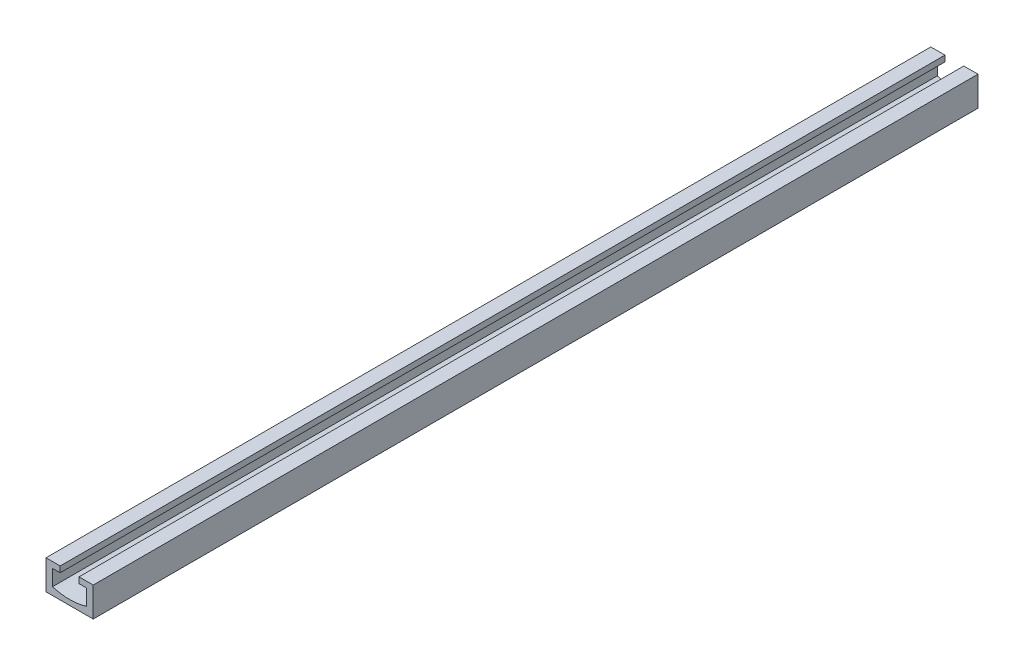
SolidWorks part; units mm, degrees
ref_plane "前视基准面" through (0, 0, 0) normal (0, 0, 1) x (1, 0, 0)
ref_plane "上视基准面" through (0, 0, 0) normal (0, 1, 0) x (1, 0, 0)
ref_plane "右视基准面" through (0, 0, 0) normal (1, 0, 0) x (0, 0, -1)
sketch "草图1" plane through (0, 0, 0) normal (0, 0, 1) x (1, 0, 0)
  line L1 (-4, -2.5) -> (4, -2.5)
  line L2 (-4, -2.5) -> (-4, 2.5)
  line L3 (-4, 2.5) -> (4, 2.5)
  line L4 (4, -2.5) -> (4, 2.5)
  line L5 (-4, -2.5) -> (4, 2.5) construction
  line L6 (-4, 2.5) -> (4, -2.5) construction
  point P0 (0, 0)
  dimension "D1" = 8
  dimension "D2" = 5
extrude "凸台-拉伸1" add sketch "草图1" along normal mid plane 150
sketch "草图2" plane through (0, 0, 75) normal (0, 0, 1) x (1, 0, 0)
  line L0 (0, 2.5) -> (0, -3.7958) construction
  line L1 (4, 2.5) -> (-4, 2.5) construction
  line L2 (-1.6, 2.5) -> (1.6, 2.5)
  line L3 (1.6, 2.5) -> (1.6, 1.5)
  line L4 (1.6, 1.5) -> (2.9, 1.5)
  line L5 (2.9, 1.5) -> (2.9, -1.2)
  line L6 (-2.9, 1.5) -> (-2.9, -1.2)
  line L7 (-1.6, 1.5) -> (-2.9, 1.5)
  line L8 (-1.6, 2.5) -> (-1.6, 1.5)
  arc A0 (-2.9, -1.2) -> (2.9, -1.2) centre (0, 8.3703) ccw
  dimension "D5" = 10
  dimension "D1" = 3.2
  dimension "D2" = 5.8
  dimension "D3" = 1
  dimension "D4" = 2.7
extrude "切除-拉伸1" cut sketch "草图2" against normal through all
sketch "草图3" plane through (0, -2.5, 0) normal (0, -1, 0) x (1, 0, 0)
  line L0 (0, 75) -> (0, 40) construction
  line L1 (-4, 75) -> (4, 75) construction
  circle A0 centre (0, 40) radius 1.5
  dimension "D1" = 3
  dimension "D2" = 35
extrude "切除-拉伸2" cut sketch "草图3" against normal through all
chamfer "倒角1" distance 0.5 angle 45 1 edges at (-0.3261, -1.6244, 41.4641)
pattern_linear "阵列(线性)1" count 2 spacing 80 along (0, 0, -1) of "切除-拉伸2", "倒角1"
